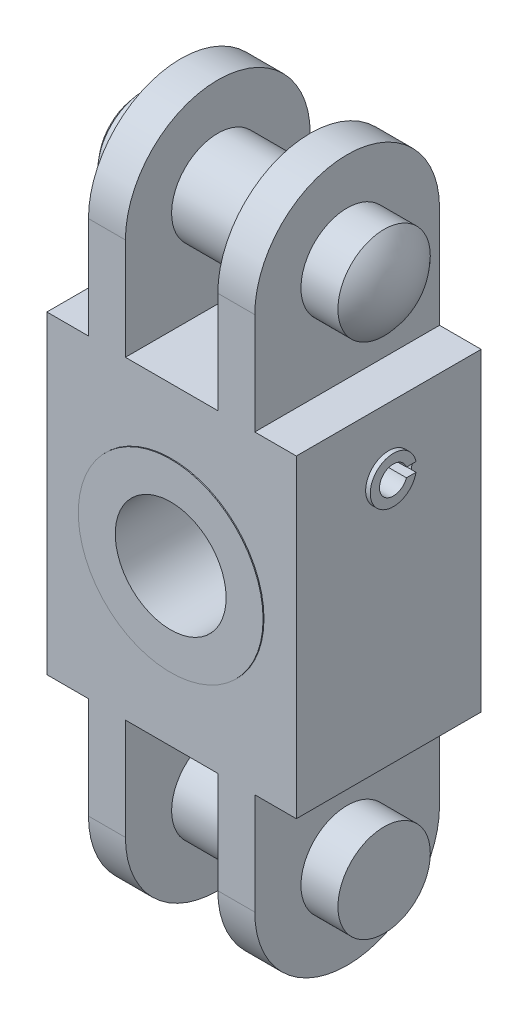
SolidWorks part; units mm, degrees
ref_plane "Plan 1" through (0, 0, 0) normal (0, 0, 1) x (1, 0, 0)
ref_plane "Plan 2" through (0, 0, 0) normal (0, 1, 0) x (1, 0, 0)
ref_plane "Plan 3" through (0, 0, 0) normal (1, 0, 0) x (0, 0, -1)
sketch "Esquisse1" plane through (0, 0, 0) normal (0, 0, 1) x (1, 0, 0)
  line L0 (0, -50) -> (0, 72) construction
  line L1 (-13.5, -17) -> (-13.5, 17)
  line L2 (-13.5, 17) -> (-9, 17)
  line L3 (-9, 17) -> (-9, 38)
  line L4 (-9, 38) -> (-5, 38)
  line L5 (-5, 38) -> (-5, 17)
  line L6 (-5, 17) -> (5, 17)
  line L7 (5, 38) -> (5, 17)
  line L8 (9, 38) -> (5, 38)
  line L9 (9, 17) -> (9, 38)
  line L10 (13.5, 17) -> (9, 17)
  line L11 (13.5, -17) -> (13.5, 17)
  line L12 (-13.5, 0) -> (13.5, 0) construction
  line L13 (13.5, -17) -> (9, -17)
  line L14 (9, -17) -> (9, -38)
  line L15 (9, -38) -> (5, -38)
  line L16 (5, -38) -> (5, -17)
  line L17 (-5, -17) -> (5, -17)
  line L18 (-5, -38) -> (-5, -17)
  line L19 (-9, -38) -> (-5, -38)
  line L20 (-9, -17) -> (-9, -38)
  line L21 (-13.5, -17) -> (-9, -17)
  circle A0 centre (0, 0) radius 10
  point P11 (0, 17)
  point P26 (0, -17)
  dimension "D4" = 20
  dimension "D1" = 27
  dimension "D2" = 4
  dimension "D3" = 10
  dimension "D5" = 34
  dimension "D6" = 76
extrude "Base-Extrusion" add sketch "Esquisse1" along normal mid plane 20
sketch "Esquisse2" plane through (-13.5, 0, 0) normal (-1, 0, 0) x (0, 0, 1)
  line L0 (-10, 0) -> (10, 0) construction
  line L1 (10, 0) -> (-10, 0) construction
  line L2 (-10, 38) -> (-10, 17) construction
  line L3 (10, 38) -> (10, 17) construction
  line L4 (10, 38) -> (-10, 38) construction
  line L5 (-10, 28) -> (-10, -28)
  line L6 (10, 28) -> (10, -28)
  arc A0 (-10, 28) -> (10, 28) centre (0, 28) cw
  arc A1 (-10, -28) -> (10, -28) centre (0, -28) ccw
extrude "Détourage" cut sketch "Esquisse2" against normal through all flip side to cut
sketch "Esquisse3" plane through (-9, 0, 0) normal (-1, 0, 0) x (0, 0, 1)
  circle A0 centre (0, 28) radius 5
  circle A1 centre (0, -28) radius 5
  arc A2 (10, 28) -> (-10, 28) centre (0, 28) ccw construction
  arc A3 (-10, -28) -> (10, -28) centre (0, -28) ccw construction
  dimension "D1" = 10
extrude "Alésages" cut sketch "Esquisse3" against normal through all
sketch "Esquisse4" plane through (0, 0, 0) normal (1, 0, 0) x (0, 0, -1)
  circle A0 centre (0, -28) radius 5 construction
  circle A1 centre (0, 28) radius 5 construction
  circle A2 centre (0, -28) radius 5
  circle A3 centre (0, 28) radius 5
extrude "Axes" add sketch "Esquisse4" along normal mid plane 26
dome "Dôme1" faces to dome 1 distance 2 parameters "D1"=2
dome "Dôme2" faces to dome 1 distance 2 parameters "D1"=2
sketch "Esquisse5" plane through (0, 0, 0) normal (0, 0, 1) x (1, 0, 0)
  circle A0 centre (0, 0) radius 10 construction
  circle A1 centre (0, 0) radius 10
  circle A2 centre (0, 0) radius 6
  dimension "D1" = 4
extrude "Ecrou rapporté" add sketch "Esquisse5" along normal mid plane 20.2
sketch "Esquisse6" plane through (13.5, 0, 0) normal (1, 0, 0) x (0, 0, -1)
  circle A0 centre (0, 10) radius 2.5
  dimension "D1" = 10
  dimension "D2" = 5
extrude "Perçage" cut sketch "Esquisse6" against normal through all
sketch "Esquisse7" plane through (0, 0, 0) normal (1, 0, 0) x (0, 0, -1)
  line L0 (0, 10) -> (4, 10) construction
  line L1 (1.4142, 10.5) -> (2.4495, 10.5)
  line L2 (1.4142, 9.5) -> (2.4495, 9.5)
  circle A0 centre (0, 10) radius 2.5 construction
  arc A1 (2.4495, 10.5) -> (2.4495, 9.5) centre (0, 10) ccw
  arc A2 (1.4142, 10.5) -> (1.4142, 9.5) centre (0, 10) ccw
  dimension "D2" = 1
  dimension "D1" = 1
extrude "Goupille" add sketch "Esquisse7" along normal mid plane 28
ref_plane "Plan tg" through (-15, 0, 0) normal (1, 0, 0) x (0, 0, -1)
sketch "Point M" plane through (-15, 0, 0) normal (1, 0, 0) x (0, 0, -1)
  point P0 (0, 28)
